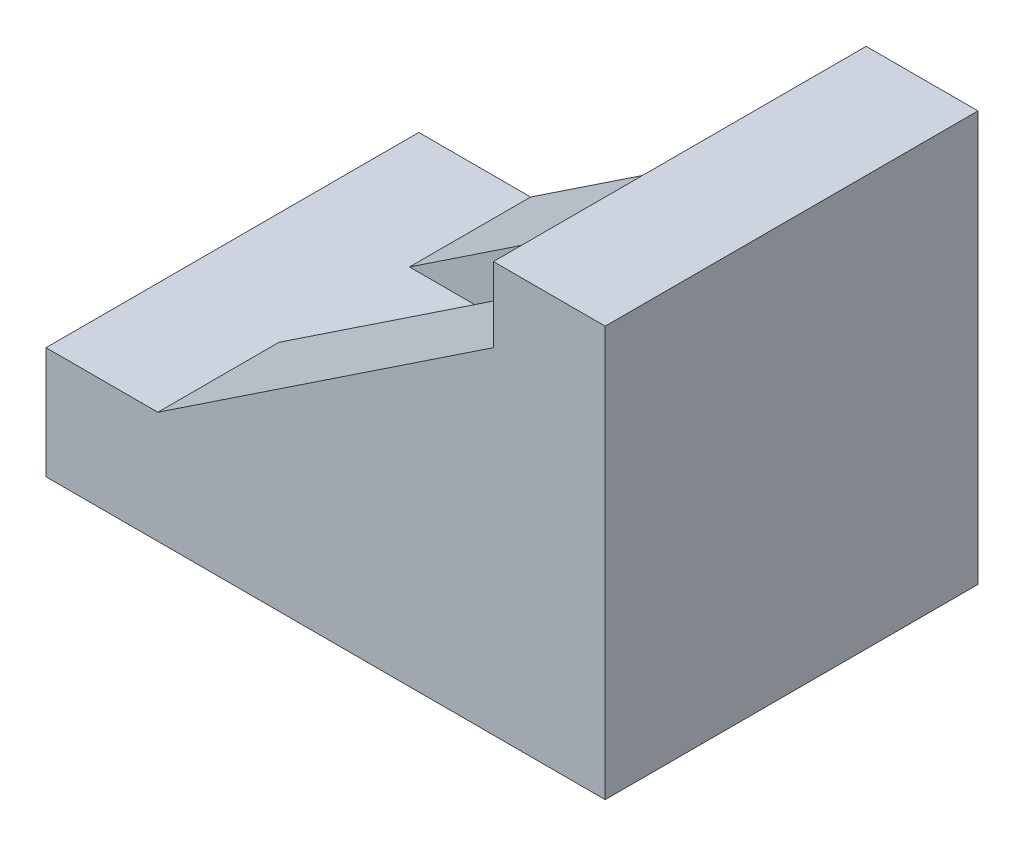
SolidWorks part; units mm, degrees
ref_plane "前视基准面" through (0, 0, 0) normal (0, 0, 1) x (1, 0, 0)
ref_plane "上视基准面" through (0, 0, 0) normal (0, 1, 0) x (1, 0, 0)
ref_plane "右视基准面" through (0, 0, 0) normal (1, 0, 0) x (0, 0, -1)
sketch "草图1" plane through (0, 0, 0) normal (0, 0, 1) x (1, 0, 0)
  line L0 (0, 0) -> (30, 0)
  line L1 (30, 0) -> (30, 22)
  line L2 (30, 22) -> (24, 22)
  line L3 (0, 0) -> (0, 6)
  line L4 (0, 6) -> (6, 6)
  line L5 (24, 22) -> (24, 18)
  line L6 (24, 18) -> (6, 6)
  dimension "D1" = 6
  dimension "D2" = 22
  dimension "D3" = 30
  dimension "D4" = 6
extrude "拉伸1" add sketch "草图1" along normal mid plane 20
sketch "草图2" plane through (0, 0, 0) normal (0, 0, 1) x (1, 0, 0)
  line L0 (24, 18) -> (24, 6)
  line L1 (24, 6) -> (6, 6)
  line L2 (24, 18) -> (6, 6)
extrude "切除-拉伸1" cut sketch "草图2" against normal mid plane 7
